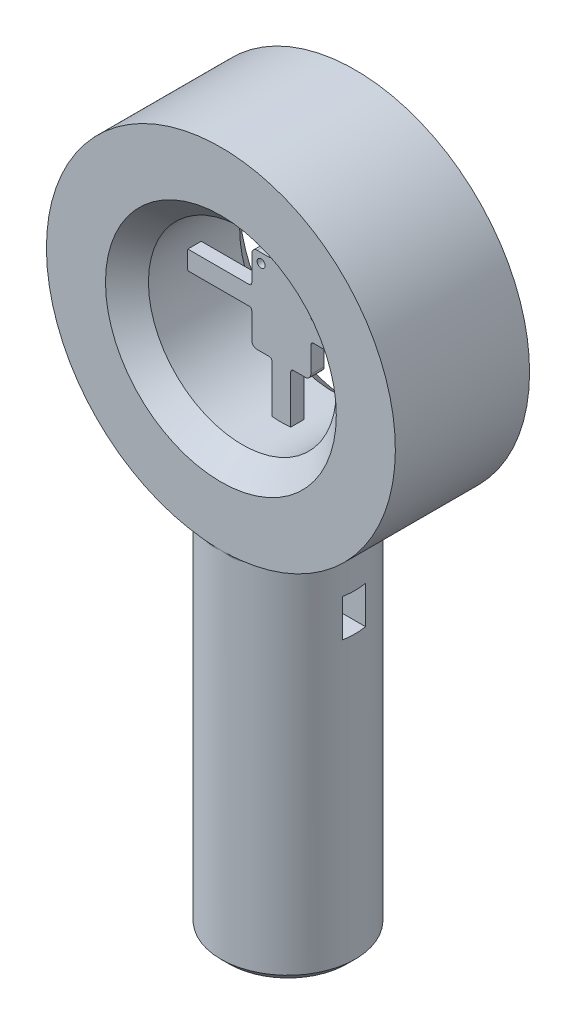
SolidWorks part; units mm, degrees
other "<臭屁探测器>-<倒角2>"
ref_plane "前视基准面" through (0, 0, 0) normal (0, 0, 1) x (1, 0, 0)
ref_plane "上视基准面" through (0, 0, 0) normal (0, 1, 0) x (1, 0, 0)
ref_plane "右视基准面" through (0, 0, 0) normal (1, 0, 0) x (0, 0, -1)
inserted part "臭屁探测器"
ref_plane "基准面2" through (0, 85, 0) normal (0, 1, 0) x (1, 0, 0)
sketch "草图2" plane through (0, 85, 0) normal (0, 1, 0) x (1, 0, 0)
  circle A0 centre (0, 0) radius 37.5607
sketch "草图3" plane through (0, 0, 0) normal (1, 0, 0) x (0, 0, -1)
  line L1 (-4.25, 122) -> (4.25, 122)
  line L2 (-4.25, 122) -> (-4.25, 108)
  line L3 (-4.25, 108) -> (4.25, 108)
  line L4 (4.25, 122) -> (4.25, 108)
  line L5 (-4.25, 122) -> (4.25, 108) construction
  line L6 (-4.25, 108) -> (4.25, 122) construction
  point P0 (0, 115)
  dimension "D1" = 14
  dimension "D2" = 8.5
  dimension "D3" = 115
ref_plane "基准面3" through (25, 0, 0) normal (1, 0, 0) x (0, 0, -1)
sketch "草图4" plane through (25, 0, 0) normal (1, 0, 0) x (0, 0, -1)
  line L0 (-4.25, 122) -> (4.25, 108) construction
  line L1 (-4.25, 108) -> (4.25, 122) construction
  line L2 (-4.25, 122) -> (-4.25, 108) construction
  line L3 (-4.25, 108) -> (4.25, 108) construction
  line L4 (4.25, 122) -> (4.25, 108) construction
  line L5 (-4.25, 122) -> (4.25, 122) construction
  line L6 (-4.25, 122) -> (4.25, 108) construction
  line L7 (-4.25, 108) -> (4.25, 122) construction
  line L8 (-4.25, 122) -> (-4.25, 108)
  line L9 (-4.25, 108) -> (4.25, 108)
  line L10 (4.25, 122) -> (4.25, 108)
  line L11 (-4.25, 122) -> (4.25, 122)
  point P0 (0, 115)
extrude "切除-拉伸2" cut sketch "草图4" against normal blind 9
